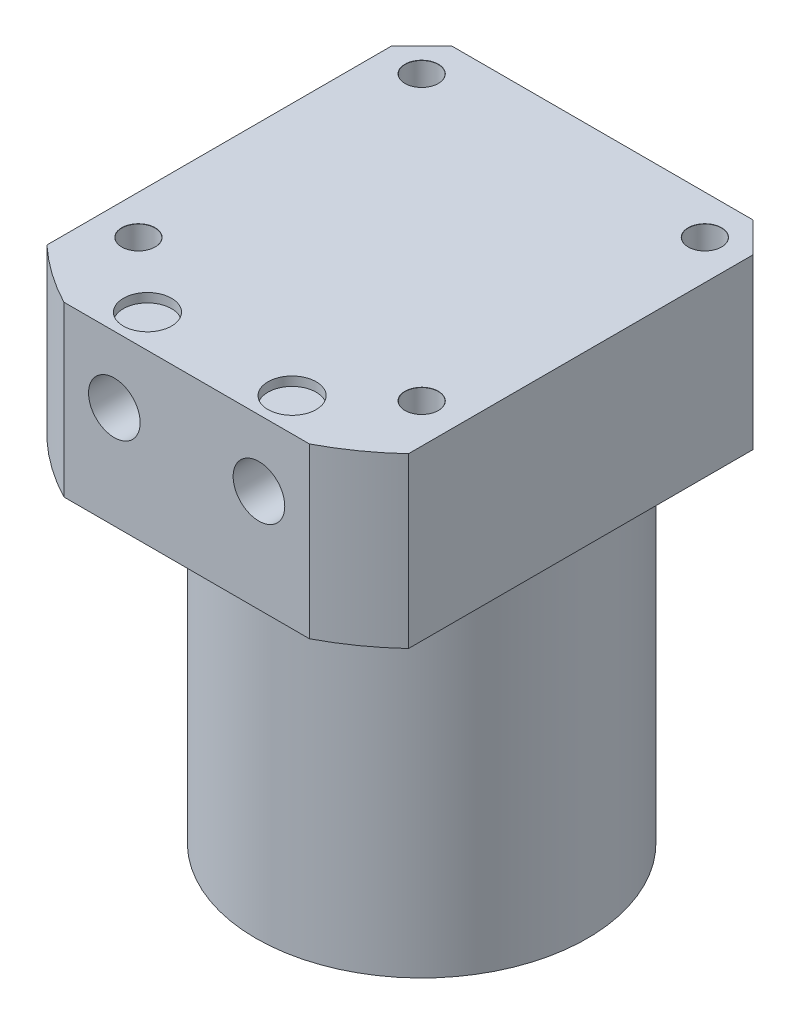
SolidWorks part; units mm, degrees
ref_plane "Front Plane" through (0, 0, 0) normal (0, 0, 1) x (1, 0, 0)
ref_plane "Top Plane" through (0, 0, 0) normal (0, 1, 0) x (1, 0, 0)
ref_plane "Right Plane" through (0, 0, 0) normal (1, 0, 0) x (0, 0, -1)
sketch "Sketch1" plane through (0, 0, 0) normal (0, 0, 1) x (1, 0, 0)
  line L0 (0, 87.0508) -> (0, 0) construction
  line L1 (0, 0) -> (-27.5, 0)
  line L2 (-27.5, 0) -> (-27.5, 59)
  line L3 (-27.5, 59) -> (-44, 59)
  line L4 (-44, 59) -> (-44, 87)
  line L6 (-44, 87) -> (0, 87)
  line L7 (0, 0) -> (0, 87)
  dimension "D1" = 27.5
  dimension "D2" = 59
  dimension "D3" = 44
  dimension "D5" = 28
revolve "Revolve1" add sketch "Sketch1" angle 360 about L0
sketch "Sketch2" plane through (0, 87, 0) normal (0, 1, 0) x (1, 0, 0)
  line L0 (0, 0) -> (0, 30) construction
  line L1 (-30, 30) -> (30, 30)
  line L2 (-30, 30) -> (-30, -39)
  line L3 (-30, -39) -> (30, -39)
  line L4 (30, 30) -> (30, -39)
  dimension "D1" = 69
  dimension "D2" = 60
  dimension "D3" = 30
extrude "Cut-Extrude2" cut sketch "Sketch2" against normal through all flip side to cut
chamfer "Chamfer1" distance 5 angle 45 2 edges at (30, 73, -30) (-30, 73, -30)
hole_wizard "Ø8.0 (8) Diameter Hole1" positions "Sketch4" profile "Sketch3" hole size "Ø8.0" standard "ISO"
sketch "Sketch4" plane through (-22.9405, 87, 22.7051) normal (0, -1, 0) x (1, 0, 0)
  line L0 (10.9405, 10.7949) -> (34.9405, 10.7949) construction
  line L2 (22.9405, 10.7949) -> (22.9405, -22.7051) construction
  point P0 (10.9405, 10.7949)
  point P1 (34.9405, 10.7949)
  dimension "D1" = 24
  dimension "D2" = 33.5
sketch "Sketch3" plane through (-12, 87, 33.5) normal (1, 0, 0) x (0, 0, 1)
  line L0 (0, 0) -> (0, 1.5)
  line L1 (0, 1.5) -> (4, 1.5)
  line L2 (4, 1.5) -> (4, 0)
  line L5 (4, 0) -> (0, 0)
  line L10 (0, 1.5) -> (-4, 1.5) construction
  line L11 (0, -6.35) -> (0, 107.95) construction
  dimension "Hole Dia." = 8
  dimension "Hole Depth" = 1.5
  dimension "Drill Angle" = 180
hole_wizard "G1/8 Tapped Hole1" positions "Sketch6" profile "Sketch5" tap size "G1/8" standard "ISO"
sketch "Sketch6" plane through (0, 0, 39) normal (0, 0, 1) x (1, 0, 0)
  line L0 (-12, 76) -> (12, 76) construction
  line L4 (0, 76) -> (0, 87) construction
  line L5 (-20.3715, 87) -> (20.3715, 87) construction
  point P0 (-12, 76)
  point P1 (12, 76)
  dimension "D1" = 11
  dimension "D2" = 24
sketch "Sketch5" plane through (-12, 76, 39) normal (1, 0, 0) x (0, -1, 0)
  line L0 (0, 0) -> (0, 22.18)
  line L1 (0, 22.18) -> (4.283, 22.18)
  line L2 (4.283, 22.18) -> (4.283, 0)
  line L5 (4.283, 0) -> (0, 0)
  line L10 (0, 22.18) -> (-4.283, 22.18) construction
  line L11 (0, -6.35) -> (0, 107.95) construction
  dimension "Tap Drill Dia." = 8.566
  dimension "Tap Drill Depth" = 22.18
  dimension "Drill Angle" = 180
hole_wizard "CBORE for M5 Hex Socket Head Cap Screw1" positions "Sketch8" profile "Sketch7" counterbore size "M5" standard "ISO"
sketch "Sketch8" plane through (-33.2535, 59, 49.2524) normal (0, 1, 0) x (-1, 0, 0)
  line L1 (-9.7535, -25.7524) -> (-56.7535, -25.7524)
  line L2 (-9.7535, -25.7524) -> (-9.7535, -72.7524)
  line L3 (-9.7535, -72.7524) -> (-56.7535, -72.7524)
  line L4 (-56.7535, -25.7524) -> (-56.7535, -72.7524)
  line L7 (-33.2535, -49.2524) -> (-33.2535, -25.7524) construction
  line L9 (-33.2535, -49.2524) -> (-9.7535, -49.2524) construction
  point P0 (-9.7535, -72.7524)
  point P1 (-56.7535, -72.7524)
  point P3 (-56.7535, -25.7524)
  point P5 (-9.7535, -25.7524)
  dimension "D1" = 47
  dimension "D2" = 47
sketch "Sketch7" plane through (-23.5, 59, -23.5) normal (1, 0, 0) x (0, 0, -1)
  line L0 (0, 0) -> (0, 28)
  line L1 (2.75, 27.975) -> (2.775, 28)
  line L2 (2.75, 27.975) -> (2.75, 5)
  line L3 (2.75, 5) -> (5, 5)
  line L4 (5, 5) -> (5, 0)
  line L5 (5, 0) -> (0, 0)
  line L11 (0, -6.35) -> (0, 107.95) construction
  line L12 (2.775, 28) -> (0, 28)
  line L13 (-2.75, 27.975) -> (-2.775, 28) construction
  dimension "Thru Hole Dia." = 5.5
  dimension "Thru Hole Depth" = 28
  dimension "C'Bore Dia." = 10
  dimension "C'Bore Depth" = 5
  dimension "Far C'Sink Dia." = 5.55
  dimension "Far C'Sink Angle" = 90
